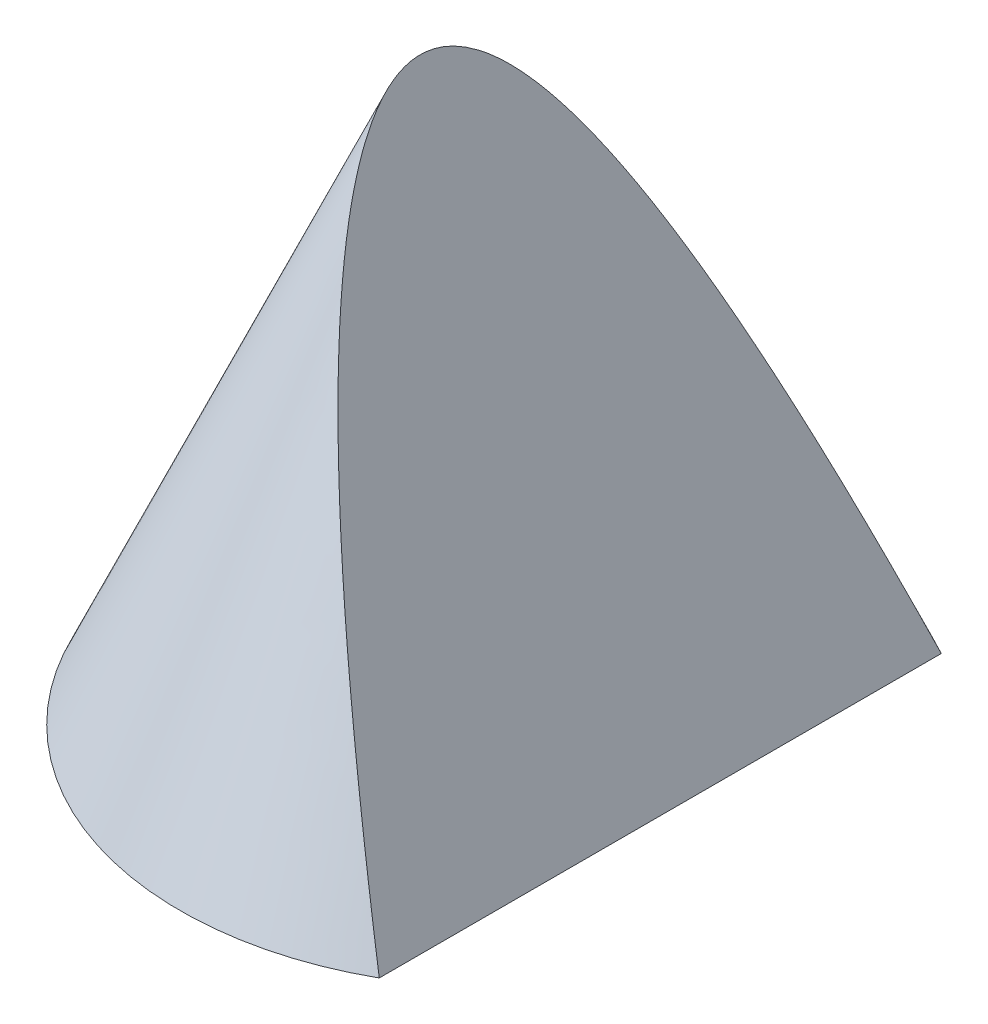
SolidWorks part; units mm, degrees
ref_plane "Front Plane" through (0, 0, 0) normal (0, 0, 1) x (1, 0, 0)
ref_plane "Top Plane" through (0, 0, 0) normal (0, 1, 0) x (1, 0, 0)
ref_plane "Right Plane" through (0, 0, 0) normal (1, 0, 0) x (0, 0, -1)
sketch "Sketch1" plane through (0, 0, 0) normal (0, 1, 0) x (1, 0, 0)
  circle A0 centre (0, 0) radius 18.4678
extrude "Extrude1" add sketch "Sketch1" along normal blind 80 draft 24
sketch "Sketch2" plane through (0, 0, 0) normal (0, 0, 1) x (1, 0, 0)
  line L0 (-4.7133, 30.8931) -> (9.0412, 0)
  line L1 (0, 41.4793) -> (-18.4678, 0) construction
  line L2 (-18.4678, 0) -> (18.4678, 0) construction
  line L3 (18.4678, 0) -> (0, 41.4793) construction
extrude "Cut-Extrude1" cut sketch "Sketch2" against normal through all and the other way through all
